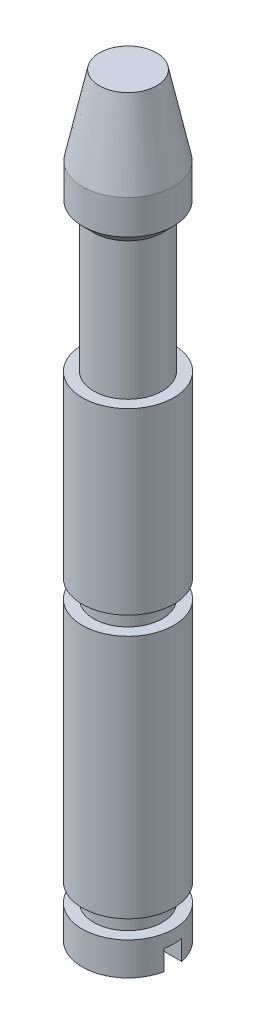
SolidWorks part; units mm, degrees
ref_plane "Front Plane" through (0, 0, 0) normal (0, 0, 1) x (1, 0, 0)
ref_plane "Top Plane" through (0, 0, 0) normal (0, 1, 0) x (1, 0, 0)
ref_plane "Right Plane" through (0, 0, 0) normal (1, 0, 0) x (0, 0, -1)
sketch "Sketch1" plane through (0, 0, 0) normal (0, 0, 1) x (1, 0, 0)
  line L0 (0, 52.3875) -> (1.9844, 52.3875)
  line L1 (1.9844, 52.3875) -> (3.1496, 46.9055)
  line L2 (3.1496, 46.9055) -> (3.1496, 44.5243)
  line L3 (3.1496, 44.5243) -> (2.3813, 43.7559)
  line L4 (2.3813, 43.7559) -> (2.3813, 34.2309)
  line L5 (2.3813, 34.2309) -> (3.175, 34.2309)
  line L6 (3.175, 34.2309) -> (3.175, 0)
  line L9 (3.175, 0) -> (0, 0)
  line L10 (0, 0) -> (0, 52.3875)
  line L11 (0, 52.3875) -> (0, 142.3692) construction
  dimension "D1" = 12
  dimension "D2" = 6.2992
  dimension "D3" = 3.9688
  dimension "D4" = 45
  dimension "D5" = 4.7625
  dimension "D6" = 2.3813
  dimension "D7" = 9.525
  dimension "D8" = 6.35
  dimension "D13" = 52.3875
revolve "Revolve1" add sketch "Sketch1" angle 360 about L11
sketch "Sketch2" plane through (0, 0, 0) normal (0, -1, 0) x (1, 0, 0)
  line L1 (-3.175, 0.6096) -> (3.175, 0.6096)
  line L2 (-3.175, 0.6096) -> (-3.175, -0.6096)
  line L3 (-3.175, -0.6096) -> (3.175, -0.6096)
  line L4 (3.175, 0.6096) -> (3.175, -0.6096)
  circle A1 centre (0, 0) radius 3.175 construction
  point P6 (-3.175, 0)
  dimension "D1" = 1.2192
extrude "Extrude1" cut sketch "Sketch2" against normal blind 1.397
sketch "Sketch3" plane through (0, 0, 0) normal (0, 0, 1) x (1, 0, 0)
  line L0 (3.175, 2.286) -> (2.3813, 2.286)
  line L1 (3.175, 1.397) -> (3.175, 34.2309) construction
  line L2 (2.3813, 2.286) -> (2.3813, 3.556)
  line L3 (2.3813, 3.556) -> (3.175, 3.556)
  line L4 (3.175, 3.556) -> (3.175, 2.286)
  line L5 (-3.1159, 0) -> (3.1159, 0) construction
  line L6 (0, 0) -> (0, 3.2128) construction
  dimension "D1" = 2.286
  dimension "D2" = 1.27
  dimension "D3" = 0.7937
revolve "Cut-Revolve1" cut sketch "Sketch3" angle 360 about L6
pattern_linear "LPattern2" count 2 spacing 18.2562 along (0, 1, 0) of "Cut-Revolve1"
